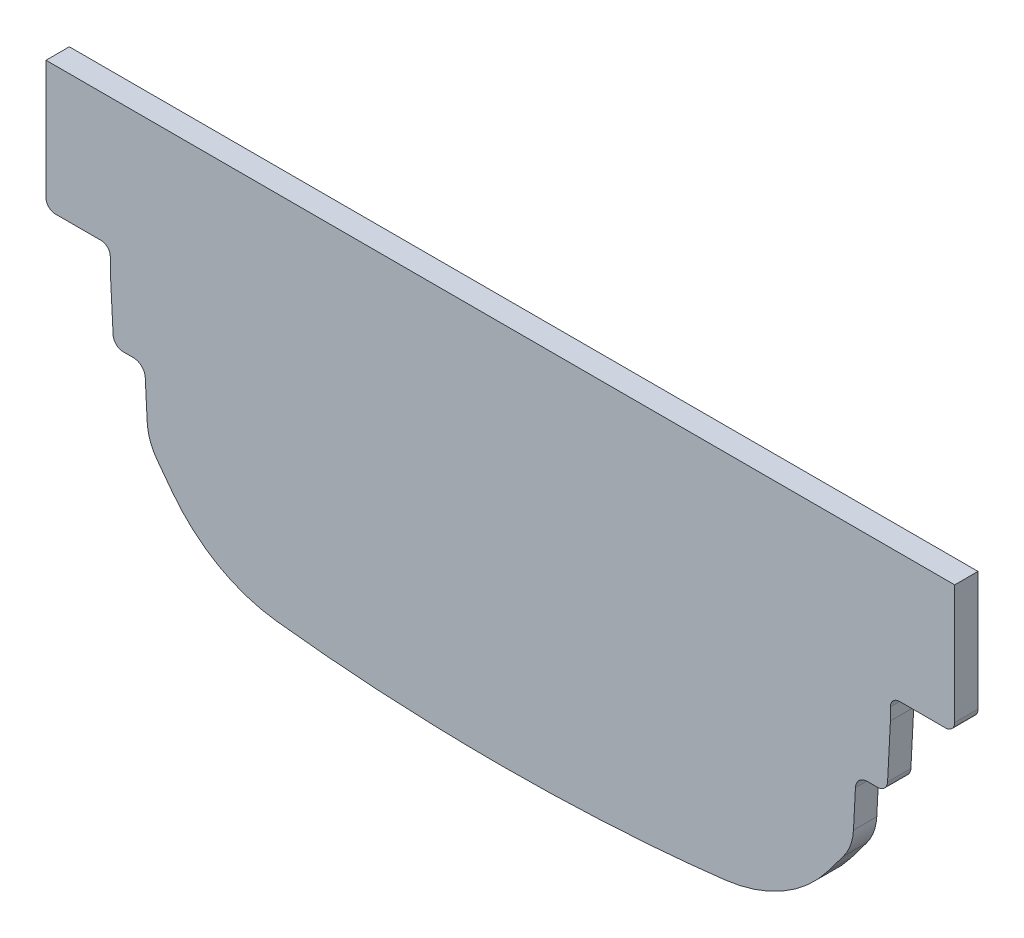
SolidWorks part; units mm, degrees
ref_plane "Front Plane" through (0, 0, 0) normal (0, 0, 1) x (1, 0, 0)
ref_plane "Top Plane" through (0, 0, 0) normal (0, 1, 0) x (1, 0, 0)
ref_plane "Right Plane" through (0, 0, 0) normal (1, 0, 0) x (0, 0, -1)
ref_plane "Plane1" through (0, 0, 64.75) normal (0, 0, 1) x (1, 0, 0)
sketch "Sketch1" plane through (0, 0, 64.75) normal (0, 0, 1) x (1, 0, 0)
  line L0 (212.4535, -16) -> (-212.4535, -16)
  line L1 (-212.4535, -91) -> (-212.4535, -97.6598)
  line L2 (-212.4535, -97.6598) -> (-210.9007, -127.2878)
  line L3 (-205.4083, -132.5) -> (-199.8922, -132.5)
  line L4 (-193.4011, -138.6598) -> (-192.3214, -159.2611)
  line L5 (-212.4535, -16) -> (-247.4535, -16)
  line L6 (-247.4535, -16) -> (-247.4535, -81)
  line L7 (-242.4535, -86) -> (-217.4535, -86)
  line L8 (242.4535, -86) -> (217.4535, -86)
  line L9 (0, -16) -> (0, -224.706) construction
  line L10 (247.4535, -16) -> (247.4535, -81)
  line L11 (212.4535, -16) -> (247.4535, -16)
  line L12 (193.4011, -138.6598) -> (192.3214, -159.2611)
  line L13 (205.4083, -132.5) -> (199.8922, -132.5)
  line L14 (212.4535, -97.6598) -> (210.9007, -127.2878)
  line L15 (212.4535, -91) -> (212.4535, -97.6598)
  arc A0 (-210.9007, -127.2878) -> (-205.4083, -132.5) centre (-205.4083, -127) ccw
  arc A1 (-199.8922, -132.5) -> (-193.4011, -138.6598) centre (-199.8922, -139) cw
  arc A2 (-192.3214, -159.2611) -> (-186.8745, -174.3013) centre (-164.8591, -157.8219) ccw
  arc A3 (-186.8745, -174.3013) -> (-178.5522, -185.3824) centre (3277.9408, 2419.2418) ccw
  arc A4 (-178.5522, -185.3824) -> (-122.2134, -217.7426) centre (-112.5, -135.609) ccw
  arc A5 (178.5522, -185.3824) -> (122.2134, -217.7426) centre (112.5, -135.609) cw
  arc A6 (186.8745, -174.3013) -> (178.5522, -185.3824) centre (-3277.9408, 2419.2418) cw
  arc A7 (192.3214, -159.2611) -> (186.8745, -174.3013) centre (164.8591, -157.8219) cw
  arc A8 (199.8922, -132.5) -> (193.4011, -138.6598) centre (199.8922, -139) ccw
  arc A9 (210.9007, -127.2878) -> (205.4083, -132.5) centre (205.4083, -127) cw
  arc A10 (217.4535, -86) -> (212.4535, -91) centre (217.4535, -91) ccw
  arc A11 (242.4535, -86) -> (247.4535, -81) centre (242.4535, -81) ccw
  arc A12 (-247.4535, -81) -> (-242.4535, -86) centre (-242.4535, -81) ccw
  arc A13 (-217.4535, -86) -> (-212.4535, -91) centre (-217.4535, -91) cw
  spline S0 degree 3 poles (-122.2134, -217.7426) (-101.9459, -220.1395) (-61.2537, -223.5885) (-20.4164, -224.706) (0, -224.706) knots 0 0 0 0 0.25 0.499956 0.499956 0.499956 0.499956
  spline S1 degree 3 poles (122.2134, -217.7426) (101.9459, -220.1395) (61.2537, -223.5885) (20.4164, -224.706) (0, -224.706) knots 0 0 0 0 0.25 0.499956 0.499956 0.499956 0.499956
  point P41 (212.4535, -86)
  point P44 (247.4535, -86)
  point P47 (-247.4535, -86)
  point P50 (-212.4535, -86)
  dimension "D3" = 5
  dimension "D1" = 70
  dimension "D2" = 35
extrude "Boss-Extrude1" add sketch "Sketch1" against normal blind 12.7
